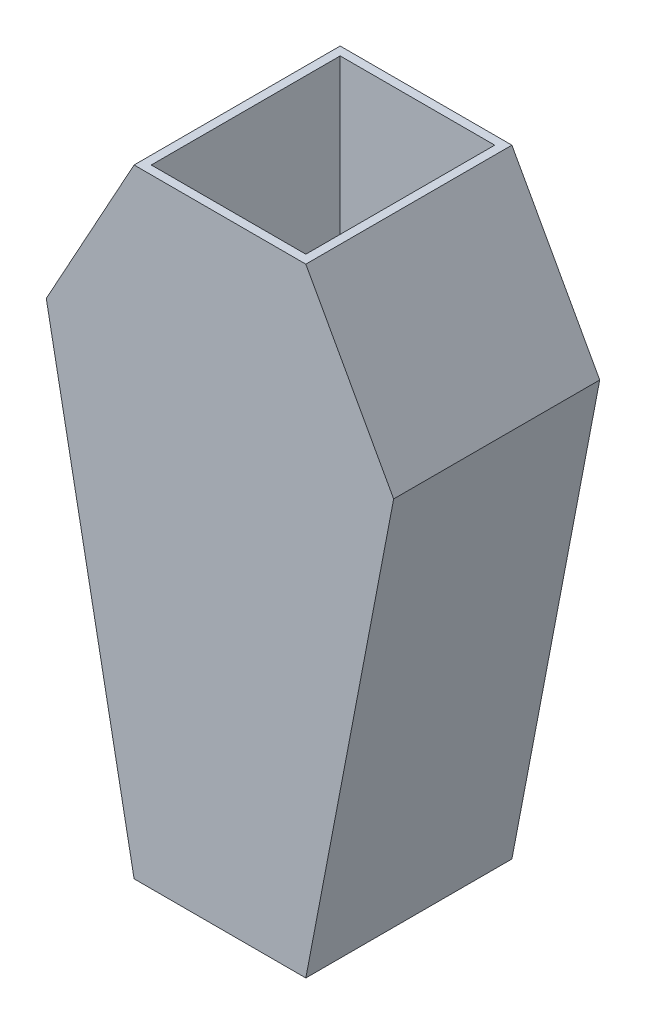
SolidWorks part; units mm, degrees
ref_plane "Front Plane" through (0, 0, 0) normal (0, 0, 1) x (1, 0, 0)
ref_plane "Top Plane" through (0, 0, 0) normal (0, 1, 0) x (1, 0, 0)
ref_plane "Right Plane" through (0, 0, 0) normal (1, 0, 0) x (0, 0, -1)
sketch "Sketch1" plane through (0, 0, 0) normal (0, 0, 1) x (1, 0, 0)
  line L0 (63.5, 228.6) -> (95.9713, 169.6403)
  line L1 (0, 0) -> (63.5, 0)
  line L2 (0, 0) -> (0, 228.6)
  line L3 (0, 228.6) -> (63.5, 228.6)
  line L4 (63.5, 0) -> (63.5, 228.6)
  line L5 (95.9713, 169.6403) -> (63.5, 0)
  line L6 (31.75, 228.6) -> (31.75, 0)
  line L7 (-32.4713, 169.6402) -> (0, 0)
  line L8 (0, 228.6) -> (-32.4713, 169.6402)
  dimension "D1" = 228.6
  dimension "D2" = 63.5
  dimension "D3" = 67.31
  dimension "D4" = 172.72
extrude "Boss-Extrude1" add sketch "Sketch1" along normal blind 76.2 contours L2 L8 L7 | L6 L3 L2 L1 | L3 L6 L1 L4 | L5 L0 L4
sketch "Sketch2" plane through (0, 228.6, 0) normal (0, 1, 0) x (1, 0, 0)
  line L1 (0, 0) -> (63.5, 0)
  line L2 (0, 0) -> (0, -76.2)
  line L3 (0, -76.2) -> (63.5, -76.2)
  line L4 (63.5, 0) -> (63.5, -76.2)
  line L5 (3.175, -3.175) -> (60.325, -3.175)
  line L6 (3.175, -3.175) -> (3.175, -73.025)
  line L7 (3.175, -73.025) -> (60.325, -73.025)
  line L8 (60.325, -3.175) -> (60.325, -73.025)
  dimension "D1" = 3.175
  dimension "D2" = 3.175
  dimension "D3" = 3.175
  dimension "D4" = 3.175
extrude "Cut-Extrude2" cut sketch "Sketch2" against normal blind 215.9 contours L8 L5 L6 L7
